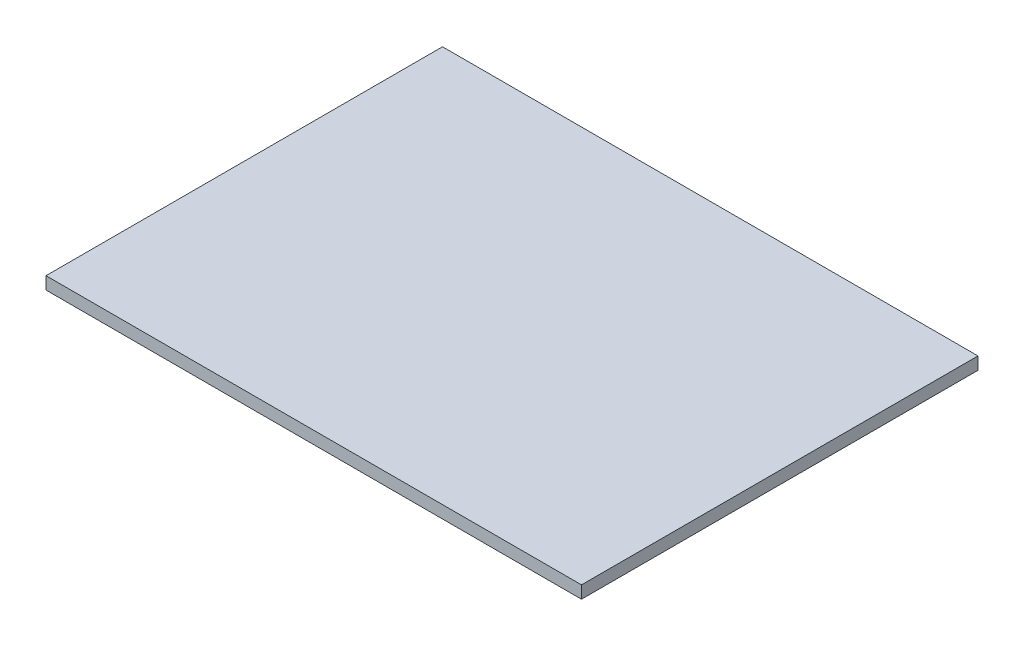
SolidWorks part; units mm, degrees
ref_plane "Front Plane" through (0, 0, 0) normal (0, 0, 1) x (1, 0, 0)
ref_plane "Top Plane" through (0, 0, 0) normal (0, 1, 0) x (1, 0, 0)
ref_plane "Right Plane" through (0, 0, 0) normal (1, 0, 0) x (0, 0, -1)
sketch "Sketch1" plane through (0, 0, 0) normal (0, 1, 0) x (1, 0, 0)
  line L1 (-8.1201, -11.6597) -> (100.9811, -11.6597)
  line L2 (-8.1201, -11.6597) -> (-8.1201, 69.1252)
  line L3 (-8.1201, 69.1252) -> (100.9811, 69.1252)
  line L4 (100.9811, -11.6597) -> (100.9811, 69.1252)
extrude "Boss-Extrude1" add sketch "Sketch1" along normal blind 2.54
